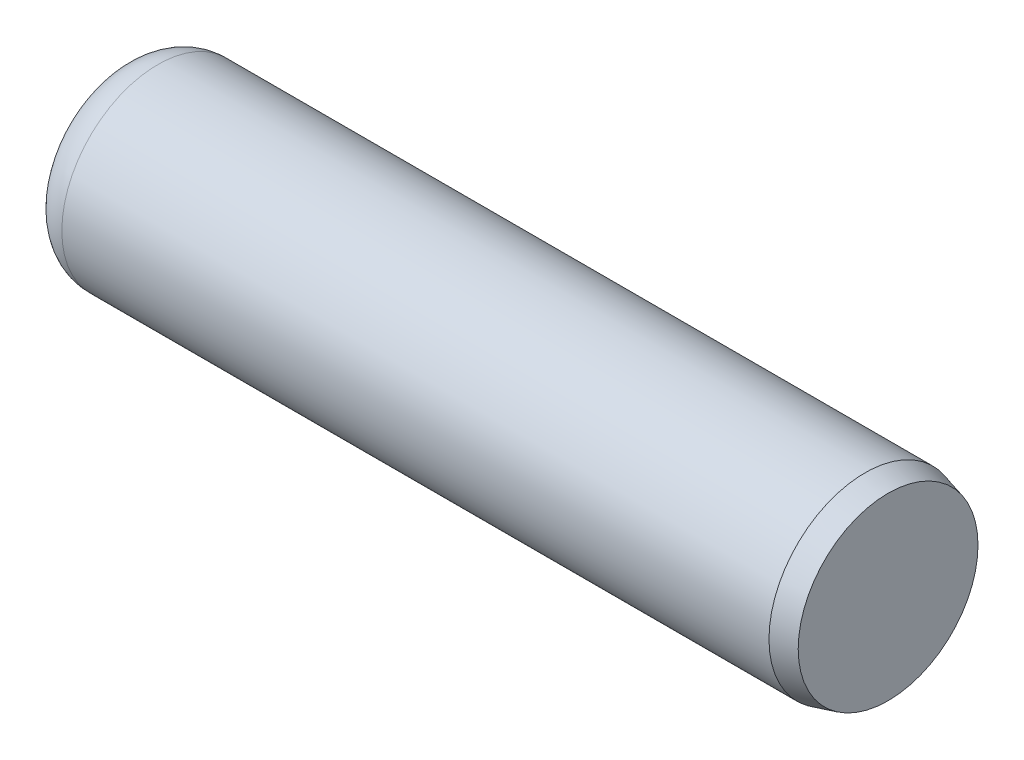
SolidWorks part; units mm, degrees
ref_plane "Plane1" through (0, 0, 0) normal (0, 0, 1) x (1, 0, 0)
ref_plane "Plane2" through (0, 0, 0) normal (0, 1, 0) x (1, 0, 0)
ref_plane "Plane3" through (0, 0, 0) normal (1, 0, 0) x (0, 0, -1)
sketch "Sketch1" plane through (0, 0, 0) normal (0, 0, 1) x (1, 0, 0)
  line L1 (-6.35, 0) -> (107.95, 0) construction
  line L2 (0, 0) -> (101.6, 0)
  line L3 (101.6, 0) -> (101.6, 11.8833)
  line L4 (101.6, 11.8833) -> (98.552, 12.7)
  line L5 (98.552, 12.7) -> (5.08, 12.7)
  line L6 (0, 7.62) -> (0, 0)
  arc A0 (5.08, 12.7) -> (0, 7.62) centre (5.08, 7.62) ccw
  dimension "D4" = 5.08
  dimension "D2" = 3.048
  dimension "D3" = 15
  dimension "Diameter" = 25.4
  dimension "Length" = 101.6
revolve "Base-Revolve" add sketch "Sketch1" angle 360 about L1
equation "\"D4@Sketch1\" = \"Diameter@Sketch1\" * 0.2"
equation "\"D2@Sketch1\" = \"Diameter@Sketch1\" * 0.12"
equation "\"D3@Sketch1\" = 15.0"
